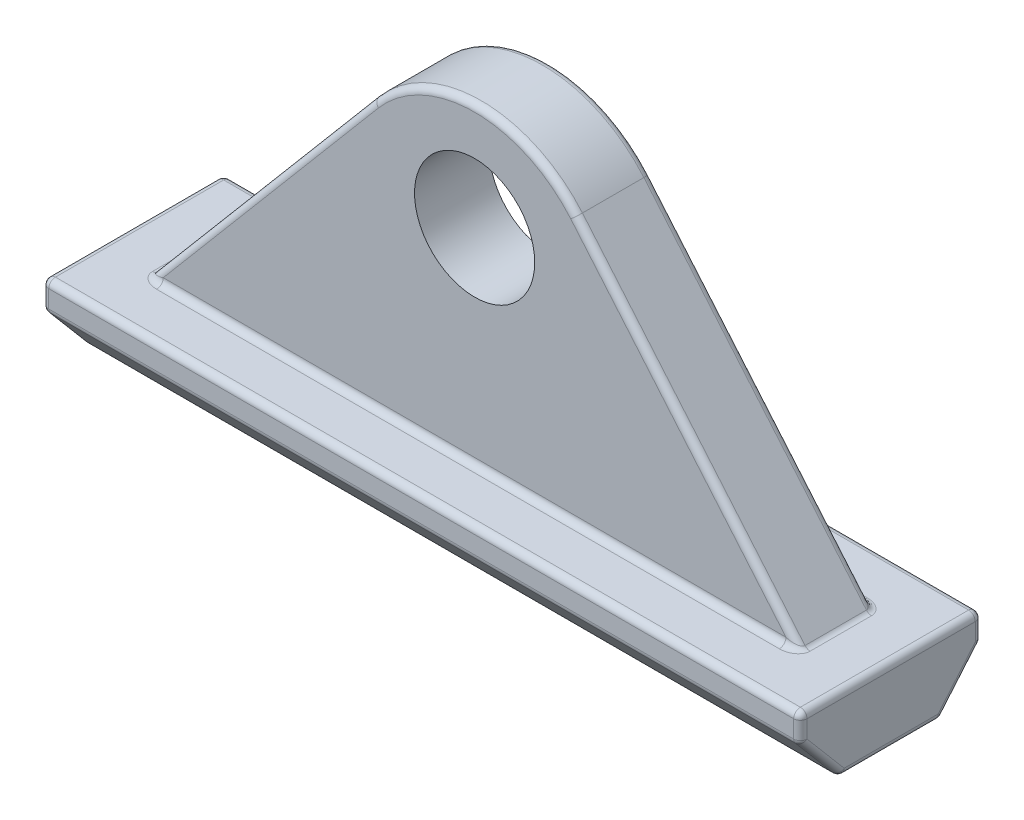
SolidWorks part; units mm, degrees
ref_plane "Front Plane" through (0, 0, 0) normal (0, 0, 1) x (1, 0, 0)
ref_plane "Top Plane" through (0, 0, 0) normal (0, 1, 0) x (1, 0, 0)
ref_plane "Right Plane" through (0, 0, 0) normal (1, 0, 0) x (0, 0, -1)
sketch "Sketch2" plane through (0, 0, 0) normal (1, 0, 0) x (0, 0, -1)
  line L0 (-6.8, 0) -> (6.8, 0)
  line L1 (-6.8, 0) -> (-6.8, -2)
  line L2 (-6.8, -2) -> (-3.75, -5.6)
  line L3 (-3.75, -5.6) -> (3.75, -5.6)
  line L4 (6.8, 0) -> (6.8, -2)
  line L5 (6.8, -2) -> (3.75, -5.6)
  line L6 (0, 1.3095) -> (0, -1.3095) construction
  point P10 (0, 0)
  dimension "D1" = 13.6
  dimension "D2" = 2
  dimension "D3" = 7.5
  dimension "D4" = 5.6
  dimension "D5" = 6.8
extrude "Boss-Extrude1" add sketch "Sketch2" along normal blind 56.8
sketch "Sketch4" plane through (0, 0, 0) normal (0, 1, 0) x (1, 0, 0)
  line L0 (0, 6.8) -> (0, -6.8) construction
  line L1 (4, 2.8) -> (52.8, 2.8)
  line L2 (4, 2.8) -> (4, -2.8)
  line L3 (4, -2.8) -> (52.8, -2.8)
  line L4 (52.8, 2.8) -> (52.8, -2.8)
  line L5 (56.8, 6.8) -> (56.8, -6.8) construction
  line L6 (56.8, 6.8) -> (0, 6.8) construction
  line L7 (56.8, -6.8) -> (0, -6.8) construction
  dimension "D1" = 4
  dimension "D2" = 4
  dimension "D3" = 4
  dimension "D4" = 4
extrude "Boss-Extrude2" add sketch "Sketch4" along normal blind 23.4
sketch "Sketch5" plane through (0, 0, 2.8) normal (0, 0, 1) x (1, 0, 0)
  line L0 (12.6919, 19.9) -> (44.1081, 19.9) construction
  line L1 (4, 23.4) -> (4, 0) construction
  line L2 (4, 23.4) -> (52.8, 23.4) construction
  line L4 (4, 0) -> (20.8206, 19.9)
  line L5 (52.8, 0) -> (35.9794, 19.9)
  circle A0 centre (28.4, 15.4) radius 4.5
  arc A1 (20.8206, 19.9) -> (35.9794, 19.9) centre (28.4, 13.4432) cw
  point P3 (28.4, 23.4)
  point P15 (28.4, 19.9)
  dimension "D1" = 9
  dimension "D2" = 24.4
  dimension "D3" = 8
  dimension "D4" = 3.5
extrude "Cut-Extrude1" cut sketch "Sketch5" against normal blind 23.4
fillet "Fillet1" radius 0.5 29 edges at (52.8, 0, 0) (28.4, 0, 2.8) (28.4, 23.4, 2.8) (44.3897, 9.95, 2.8) (28.4, 23.4, -2.8) (28.4, 0, -2.8) (44.3897, 9.95, -2.8) (12.4103, 9.95, -2.8) (20.8206, 19.9, 0) (12.4103, 9.95, 2.8) (4, 0, 0) (0, 0, 0) (0, -5.6, 0) (28.4, -5.6, -3.75) (0, -3.8, -5.275) (28.4, -2, -6.8) (28.4, 0, -6.8) (0, -1, -6.8) (28.4, -5.6, 3.75) (0, -3.8, 5.275) (28.4, 0, 6.8) (28.4, -2, 6.8) (0, -1, 6.8) (56.8, 0, 0) (56.8, -1, -6.8) (56.8, -3.8, -5.275) (56.8, -5.6, 0) (56.8, -3.8, 5.275) (56.8, -1, 6.8)
